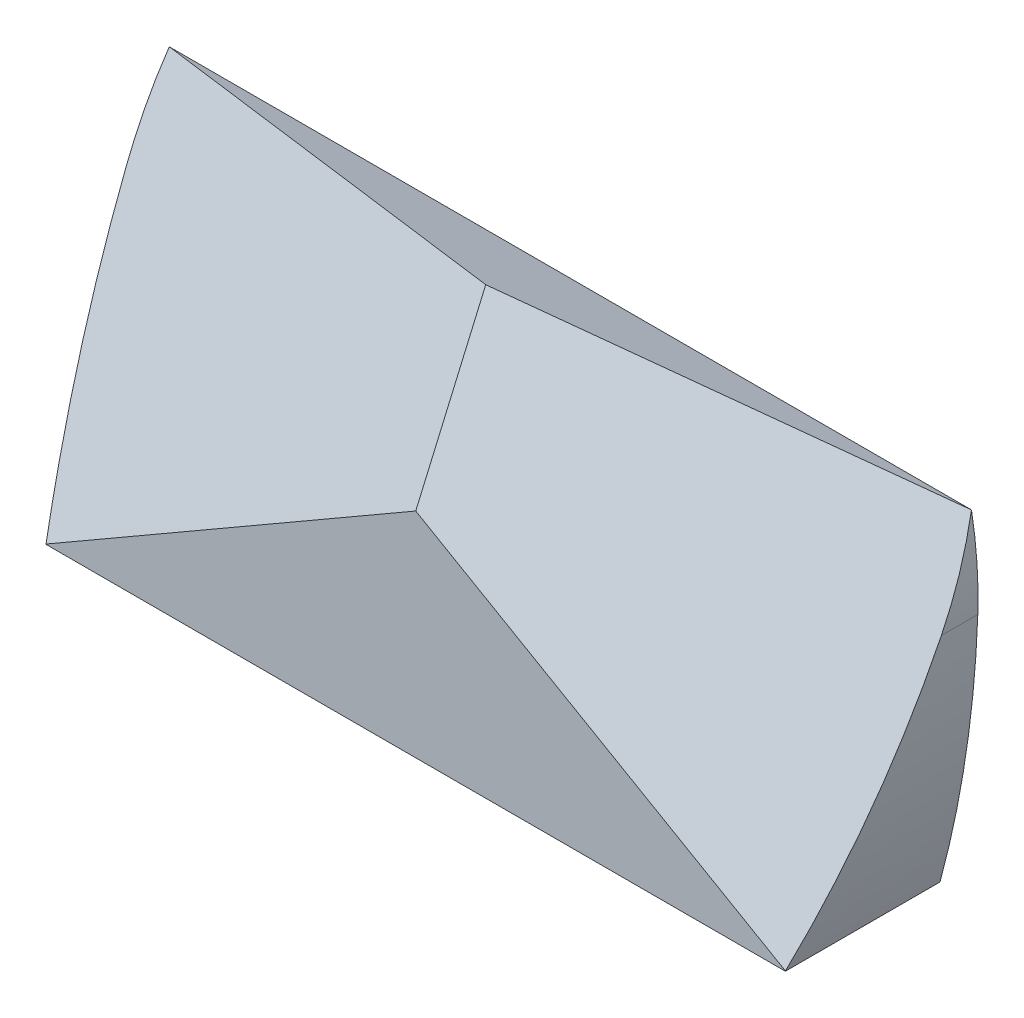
SolidWorks part; units mm, degrees
ref_plane "Ebene vorne" through (0, 0, 0) normal (0, 0, 1) x (1, 0, 0)
ref_plane "Ebene oben" through (0, 0, 0) normal (0, 1, 0) x (1, 0, 0)
ref_plane "Ebene rechts" through (0, 0, 0) normal (1, 0, 0) x (0, 0, -1)
ref_plane "Ebene1" through (0, 0, -5.5) normal (0, 0, 1) x (1, 0, 0)
sketch "Skizze35" plane through (0, 0, -107.7276) normal (0, 0, 1) x (1, 0, 0)
  line L3 (-16.2759, 23.2381) -> (16.2759, 23.2381)
  line L4 (-17.6614, 38.1175) -> (17.6614, 38.1175)
  arc A6 (17.9385, 34.2684) -> (17.6614, 38.1175) centre (0, 34.9116) ccw
  arc A8 (16.2759, 23.2381) -> (17.9385, 34.2684) centre (-31.165, 36.0291) ccw
  arc A10 (-17.9385, 34.2684) -> (-16.2759, 23.2381) centre (31.165, 36.0291) ccw
  arc A11 (-17.6614, 38.1175) -> (-17.9385, 34.2684) centre (0, 34.9116) ccw
ref_plane "Ebene8" through (-14.3894, -1.3399, -0.0537) normal (0.9957, 0.0927, 0.0037) x (0.0037, 0.0003, -1)
sketch "Skizze37" plane through (-14.3894, -1.3399, -0.0537) normal (0.9957, 0.0927, 0.0037) x (0.0037, 0.0003, -1)
  line L0 (107.6746, 24.647) -> (100.8647, 24.6494)
ref_plane "Ebene9" through (14.3894, -1.3399, -0.0537) normal (0.9957, -0.0927, -0.0037) x (-0.0037, 0.0003, -1)
sketch "Skizze38" plane through (14.3894, -1.3399, -0.0537) normal (0.9957, -0.0927, -0.0037) x (-0.0037, 0.0003, -1)
  line L0 (100.8647, 24.6494) -> (107.6746, 24.647)
sketch "Skizze44" plane through (-14.1377, 24.4873, 0) normal (-0.5, 0.866, 0) x (0.866, 0.5, 0)
  line L1 (16.3248, 100.9178) -> (-2.4983, 100.9178)
ref_plane "Ebene10" through (17.3859, -30.1133, -69.2692) normal (-0.2243, 0.3885, 0.8937) x (0.9745, 0.0894, 0.2057)
sketch "rechts" plane through (17.3859, -30.1133, -69.2692) normal (-0.2243, 0.3885, 0.8937) x (0.9745, 0.0894, 0.2057)
  line L1 (-17.8406, 70.177) -> (-34.5682, 61.5457)
  line L2 (-34.5682, 61.5457) -> (-35.9638, 77.9064) construction
  line L3 (-34.5682, 61.5457) -> (-35.9638, 77.9064)
  line L4 (-35.9638, 77.9064) -> (-1.5411, 77.9064) construction
  line L5 (-35.9638, 77.9064) -> (-17.8406, 77.9064)
  line L6 (-17.8406, 70.177) -> (-34.5682, 61.5457)
  line L7 (-17.8406, 70.177) -> (-17.8406, 77.9064)
sketch "Skizze46" plane through (14.1377, 24.4873, 0) normal (0.5, 0.866, 0) x (0.866, -0.5, 0)
  line L0 (-16.3248, 100.9178) -> (2.4983, 100.9178)
ref_plane "Ebene11" through (-17.3859, -30.1133, -69.2692) normal (0.2243, 0.3885, 0.8937) x (0.9745, -0.0894, -0.2057)
sketch "links" plane through (-17.3859, -30.1133, -69.2692) normal (0.2243, 0.3885, 0.8937) x (0.9745, -0.0894, -0.2057)
  line L0 (17.8406, 70.177) -> (34.5682, 61.5457) construction
  line L1 (17.8406, 70.177) -> (34.5682, 61.5457)
  line L2 (17.8406, 70.177) -> (17.8406, 77.9064) construction
  line L3 (17.8406, 70.177) -> (17.8406, 77.9064)
  line L4 (34.5682, 61.5457) -> (35.9638, 77.9064) construction
  line L5 (34.5682, 61.5457) -> (35.9638, 77.9064)
  line L6 (17.8406, 77.9064) -> (35.9638, 77.9064)
ref_plane "Ebene12" through (14.3894, -1.3399, -0.0537) normal (-0.9957, 0.0927, 0.0037) x (0.0037, -0.0003, 1)
sketch "Skizze49" plane through (14.3894, -1.3399, -0.0537) normal (-0.9957, 0.0927, 0.0037) x (0.0037, -0.0003, 1)
  line L0 (-100.8647, 24.6494) -> (-107.6746, 24.647)
ref_plane "Ebene13" through (0, 23.2381, 0) normal (0, -1, 0) x (1, 0, 0)
sketch "Skizze51" plane through (0, 23.2381, 0) normal (0, -1, 0) x (1, 0, 0)
  line L0 (-16.3013, -100.9178) -> (16.3014, -100.9178)
sketch "Skizze52" plane through (0, 23.2381, 0) normal (0, -1, 0) x (1, 0, 0)
  line L0 (-16.2759, -107.7276) -> (-16.3013, -100.9178) construction
  line L1 (-16.2759, -107.7276) -> (-16.3013, -100.9178)
  line L2 (-16.3013, -100.9178) -> (16.3014, -100.9178) construction
  line L3 (-16.3013, -100.9178) -> (16.3014, -100.9178)
  line L4 (16.3014, -100.9178) -> (16.2759, -107.7276) construction
  line L5 (16.3014, -100.9178) -> (16.2759, -107.7276)
  line L6 (-16.2759, -107.7276) -> (16.2759, -107.7276) construction
  line L7 (-16.2759, -107.7276) -> (16.2759, -107.7276)
extrude "Linear austragen1" add sketch "Skizze35" along normal blind 9
sketch "Skizze53" plane through (0, 38.1175, 0) normal (0, 1, 0) x (-1, 0, 0)
  line L1 (19.2406, -109.4695) -> (-19.5459, -109.4695)
  line L2 (19.2406, -109.4695) -> (19.2406, -97.1168)
  line L3 (19.2406, -97.1168) -> (-19.5459, -97.1168)
  line L4 (-19.5459, -109.4695) -> (-19.5459, -97.1168)
extrude "Linear austragen2" add sketch "Skizze53" along normal blind 4
ref_plane "Ebene14" through (17.3859, -30.1133, -69.2692) normal (0.2243, -0.3885, -0.8937) x (-0.9745, -0.0894, -0.2057)
sketch "Skizze54" plane through (17.3859, -30.1133, -69.2692) normal (0.2243, -0.3885, -0.8937) x (-0.9745, -0.0894, -0.2057)
  line L1 (43.423, 87.4832) -> (7.2866, 87.4832)
  line L2 (43.423, 87.4832) -> (43.423, 50.9627)
  line L3 (43.423, 50.9627) -> (7.2866, 50.9627)
  line L4 (7.2866, 87.4832) -> (7.2866, 50.9627)
extrude "Linear austragen3" cut sketch "Skizze54" against normal through all
ref_plane "Ebene15" through (-17.3859, -30.1133, -69.2692) normal (0.2243, 0.3885, 0.8937) x (0.9745, -0.0894, -0.2057)
sketch "Skizze55" plane through (-17.3859, -30.1133, -69.2692) normal (0.2243, 0.3885, 0.8937) x (0.9745, -0.0894, -0.2057)
  line L1 (8.7766, 92.6319) -> (53.2492, 92.6319)
  line L2 (8.7766, 92.6319) -> (8.7766, 48.7478)
  line L3 (8.7766, 48.7478) -> (53.2492, 48.7478)
  line L4 (53.2492, 92.6319) -> (53.2492, 48.7478)
ref_plane "Ebene16" through (0, 71.447, -31.0601) normal (0, -0.9171, 0.3987) x (1, 0, 0)
sketch "Skizze56" plane through (0, 71.447, -31.0601) normal (0, -0.9171, 0.3987) x (1, 0, 0)
  line L1 (42.0199, -63.1683) -> (-41.6281, -63.1683)
  line L2 (42.0199, -63.1683) -> (42.0199, -89.8529)
  line L3 (42.0199, -89.8529) -> (-41.6281, -89.8529)
  line L4 (-41.6281, -63.1683) -> (-41.6281, -89.8529)
extrude "Linear austragen6" cut sketch "Skizze56" against normal through all
extrude "Linear austragen7" cut sketch "Skizze55" along normal blind 4
ref_plane "Ebene17" through (0, 0, -100.9178) normal (0, 0, 1) x (1, 0, 0)
sketch "Skizze57" plane through (0, 0, -100.9178) normal (0, 0, 1) x (1, 0, 0)
  line L1 (-19.3789, 54.5378) -> (26.0691, 54.5378)
  line L2 (-19.3789, 54.5378) -> (-19.3789, 8.3282)
  line L3 (-19.3789, 8.3282) -> (26.0691, 8.3282)
  line L4 (26.0691, 54.5378) -> (26.0691, 8.3282)
extrude "Linear austragen8" cut sketch "Skizze57" along normal blind 4
